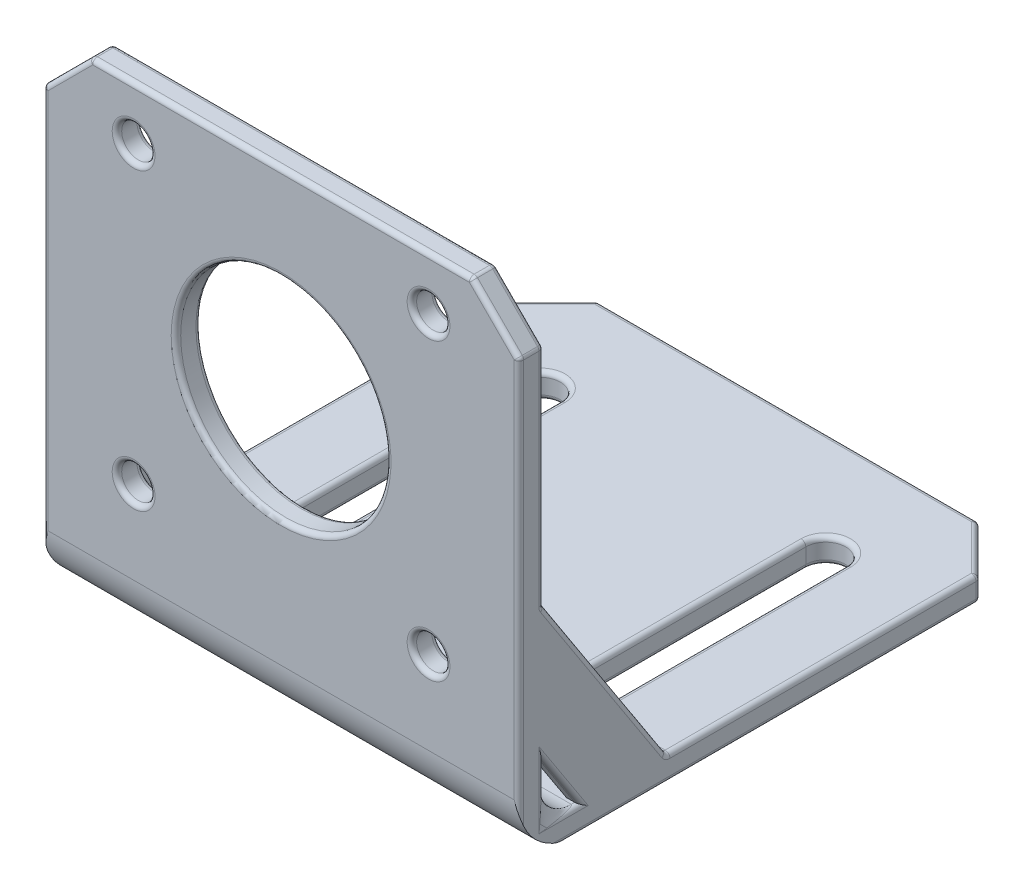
SolidWorks part; units mm, degrees
ref_plane "Ebene vorne" through (0, 0, 0) normal (0, 0, 1) x (1, 0, 0)
ref_plane "Ebene oben" through (0, 0, 0) normal (0, 1, 0) x (1, 0, 0)
ref_plane "Ebene rechts" through (0, 0, 0) normal (1, 0, 0) x (0, 0, -1)
ref_plane "Ebene1" through (-25, 0, 0) normal (-1, 0, 0) x (0, -1, 0)
sketch "Skizze1" plane through (-25, 0, 0) normal (-1, 0, 0) x (0, -1, 0)
  line L0 (21.8719, -2.6) -> (7.65, -2.6)
  line L1 (7.65, -2.6) -> (27.65, -15.6)
  line L2 (27.65, -15.6) -> (27.65, -6.3558)
  line L3 (27.65, -6.3558) -> (21.8719, -2.6)
extrude "Aufsatz-Linear austragen1" add sketch "Skizze1" against normal blind 50
ref_plane "Ebene2" through (0, 0, -2.6) normal (0, 0, -1) x (-1, 0, 0)
sketch "Skizze2" plane through (0, 0, -2.6) normal (0, 0, -1) x (-1, 0, 0)
  line L0 (25, -27.65) -> (25, 16)
  line L1 (25, 16) -> (20, 21)
  line L2 (20, 21) -> (-20, 21)
  line L3 (-20, 21) -> (-25, 16)
  line L4 (-25, 16) -> (-25, -27.65)
  line L5 (-25, -27.65) -> (25, -27.65)
extrude "Aufsatz-Linear austragen2" add sketch "Skizze2" against normal blind 2.6
ref_plane "Ebene3" through (23.625, 0, 0) normal (1, 0, 0) x (0, 0, -1)
sketch "Skizze3" plane through (23.625, 0, 0) normal (1, 0, 0) x (0, 0, -1)
  line L0 (2.6, -21.8719) -> (6.3558, -27.65)
  line L1 (6.3558, -27.65) -> (15.6, -27.65)
  line L2 (15.6, -27.65) -> (2.6, -7.65)
  line L3 (2.6, -7.65) -> (2.6, -21.8719)
extrude "Schnitt-Linear austragen1" cut sketch "Skizze3" against normal blind 47.25
sketch "Skizze4" plane through (0, -27.65, 0) normal (0, -1, 0) x (1, 0, 0)
  line L0 (25, 0) -> (25, -48.25)
  line L1 (25, -48.25) -> (20, -53.25)
  line L2 (20, -53.25) -> (-20, -53.25)
  line L3 (-20, -53.25) -> (-25, -48.25)
  line L4 (-25, -48.25) -> (-25, 0)
  line L5 (-25, 0) -> (25, 0)
extrude "Aufsatz-Linear austragen3" add sketch "Skizze4" along normal blind 2.6
sketch "Skizze5" plane through (0, -27.65, 0) normal (0, 1, 0) x (-1, 0, 0)
  line L0 (12.9, -12.25) -> (12.9, -42.25)
  line L1 (17.1, -42.25) -> (17.1, -12.25)
  arc A0 (12.9, -42.25) -> (17.1, -42.25) centre (15, -42.25) ccw
  arc A1 (17.1, -12.25) -> (12.9, -12.25) centre (15, -12.25) ccw
extrude "Schnitt-Linear austragen2" cut sketch "Skizze5" against normal through all
sketch "Skizze6" plane through (0, -30.25, 0) normal (0, -1, 0) x (1, 0, 0)
  line L0 (12.9, -12.25) -> (12.9, -42.25)
  line L1 (17.1, -42.25) -> (17.1, -12.25)
  arc A0 (12.9, -42.25) -> (17.1, -42.25) centre (15, -42.25) ccw
  arc A1 (17.1, -12.25) -> (12.9, -12.25) centre (15, -12.25) ccw
extrude "Schnitt-Linear austragen3" cut sketch "Skizze6" against normal through all
hole_wizard "Durchgangsloch für M201" positions "Skizze8" profile "Skizze7" hole size "M20" standard "ANSI Metrisch"
sketch "Skizze8" plane through (0, 0, -2.6) normal (0, 0, -1) x (-1, 0, 0)
  point P0 (0, 0)
sketch "Skizze7" plane through (0, 0, -2.6) normal (1, 0, 0) x (0, 1, 0)
  line L0 (0, 0) -> (0, 2.6)
  line L1 (0, 2.6) -> (11.05, 2.6)
  line L2 (11.05, 2.6) -> (11.05, 0)
  line L5 (11.05, 0) -> (0, 0)
  line L11 (0, -6.35) -> (0, 107.95) construction
  dimension "Bohrerdurchmesser" = 22.1
  dimension "Bohrungstiefe" = 2.6
hole_wizard "Ø3.5 (3.5) Durchmesser Bohrung1" positions "Skizze10" profile "Skizze9" hole size "Ø3.5" standard "ANSI Metrisch"
sketch "Skizze10" plane through (0, 0, 0) normal (0, 0, 1) x (1, 0, 0)
  point P0 (15.5, 15.5)
  point P1 (-15.5, -15.5)
  point P2 (15.5, -15.5)
  point P3 (-15.5, 15.5)
sketch "Skizze9" plane through (15.5, 15.5, 0) normal (1, 0, 0) x (0, -1, 0)
  line L0 (0, 0) -> (0, 53.25)
  line L1 (0, 53.25) -> (1.75, 53.25)
  line L2 (1.75, 53.25) -> (1.75, 0)
  line L5 (1.75, 0) -> (0, 0)
  line L11 (0, -6.35) -> (0, 107.95) construction
  dimension "Bohrerdurchmesser" = 3.5
  dimension "Bohrungstiefe" = 53.25
fillet "Verrundung1" radius 0.5 68 edges at (-25, -27.65, -31.925) (-25, 16, -1.3) (-25, -28.95, -48.25) (-25, -30.25, -24.125) (-25, -7.125, 0) (-22.5, 18.5, -2.6) (-22.5, -27.65, -50.75) (-20, 21, -1.3) (-22.5, 18.5, 0) (-20, -28.95, -53.25) (-22.5, -30.25, -50.75) (0, 21, -2.6) (0, -27.65, -53.25) (0, 21, 0) (20, 21, -1.3) (0, -30.25, -53.25) (20, -28.95, -53.25) (22.5, 18.5, -2.6) (25, -27.65, -31.925) (22.5, -27.65, -50.75) (22.5, 18.5, 0) (22.5, -30.25, -50.75) (25, 16, -1.3) (25, -28.95, -48.25) (25, -7.125, 0) (25, -30.25, -24.125) (-15, -27.65, -44.35) (-17.1, -27.65, -27.25) (-12.9, -27.65, -27.25) (-15, -27.65, -10.15) (-15, -30.25, -44.35) (-12.9, -30.25, -27.25) (-17.1, -30.25, -27.25) (-15, -30.25, -10.15) (25, -27.65, -4.4779) (-11.05, 0, 0) (13.75, 15.5, -2.6) (15, -27.65, -44.35) (12.9, -27.65, -27.25) (17.1, -27.65, -27.25) (15, -27.65, -10.15) (-17.25, -15.5, -2.6) (-11.05, 0, -2.6) (15, -30.25, -44.35) (17.1, -30.25, -27.25) (12.9, -30.25, -27.25) (15, -30.25, -10.15) (13.75, -15.5, -2.6) (-17.25, 15.5, -2.6) (-23.625, -17.65, -9.1) (17.25, 15.5, 0) (-13.75, 15.5, 0) (23.625, -17.65, -9.1) (24.3125, -27.65, -15.6) (-13.75, -15.5, 0) (17.25, -15.5, 0) (-25, -27.65, -4.4779) (-24.3125, -27.65, -15.6)
fillet "Verrundung2" radius 3.4 1 edges at (0, -27.65, -2.6)
fillet "Verrundung3" radius 6 1 edges at (0, -30.25, 0)
